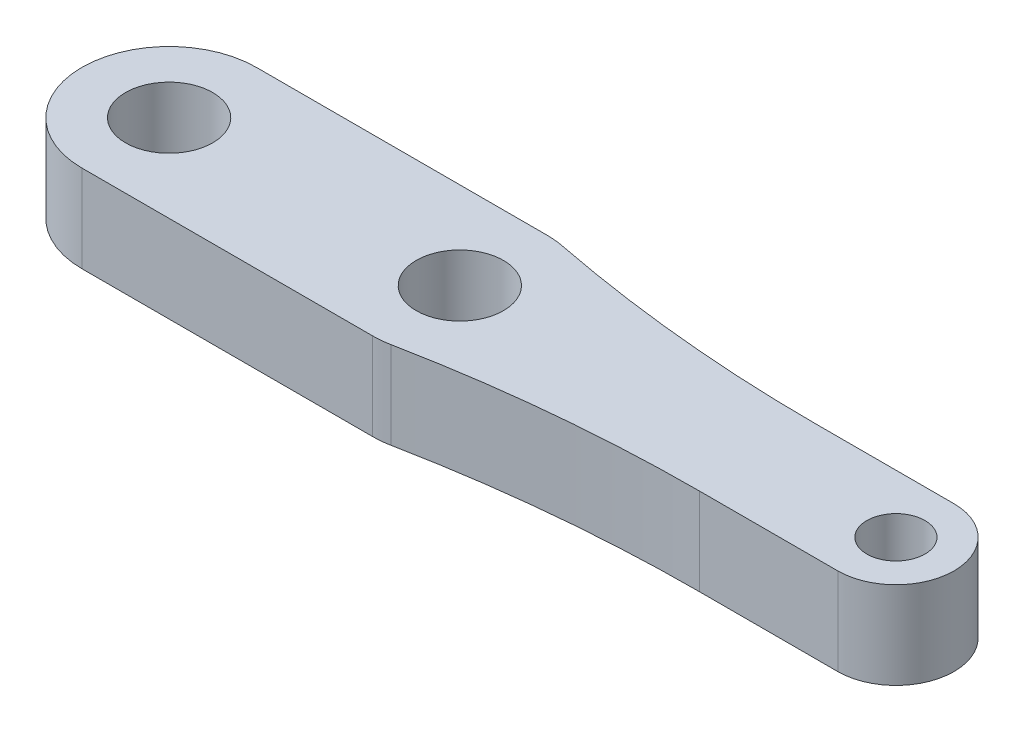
SolidWorks part; units mm, degrees
ref_plane "Front Plane" through (0, 0, 0) normal (0, 0, 1) x (1, 0, 0)
ref_plane "Top Plane" through (0, 0, 0) normal (0, 1, 0) x (1, 0, 0)
ref_plane "Right Plane" through (0, 0, 0) normal (1, 0, 0) x (0, 0, -1)
sketch "Sketch1" plane through (0, 0, 0) normal (0, 1, 0) x (1, 0, 0)
  line L0 (0, 0) -> (10, 0) construction
  line L1 (0, 3) -> (10, 3)
  line L2 (0, -3) -> (10, -3)
  line L3 (25, 0) -> (10, 0) construction
  line L4 (25, -2) -> (10, -2)
  line L5 (25, 2) -> (10, 2)
  circle A0 centre (0, 0) radius 1.5
  circle A1 centre (10, 0) radius 1.5
  arc A2 (0, 3) -> (0, -3) centre (0, 0) ccw
  arc A3 (10, -3) -> (10, 3) centre (10, 0) ccw
  circle A4 centre (25, 0) radius 1
  arc A5 (25, -2) -> (25, 2) centre (25, 0) ccw
  arc A6 (10, 2) -> (10, -2) centre (10, 0) ccw
  point P5 (5, 0)
  point P12 (17.5, 0)
  dimension "D2" = 3
  dimension "D3" = 3
  dimension "D5" = 2
  dimension "D1" = 10
  dimension "D4" = 6
  dimension "D6" = 15
  dimension "D7" = 4
extrude "Boss-Extrude1" add sketch "Sketch1" along normal blind 3 contours L4 A5 L5 A3 A4 | L5 A6 L4 A3 A1 | A6 L5 A3 L1 A2 L2 L4 A0
fillet "Fillet1" radius 50 2 edges at (12.2361, 1.5, 2) (12.2361, 1.5, -2)
